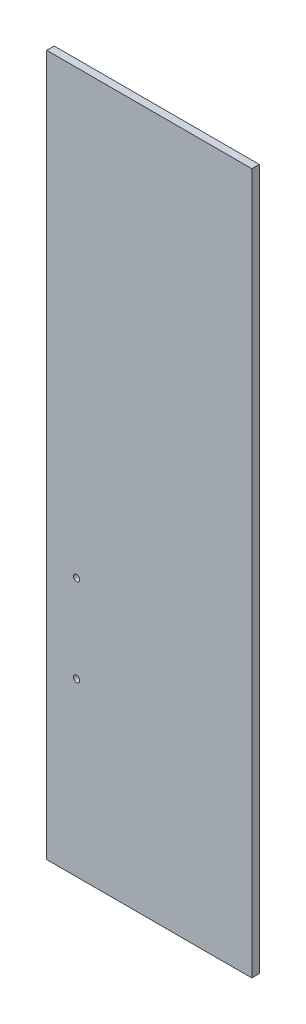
SolidWorks part; units mm, degrees
ref_plane "Plan de face" through (0, 0, 0) normal (0, 0, 1) x (1, 0, 0)
ref_plane "Plan de dessus" through (0, 0, 0) normal (0, 1, 0) x (1, 0, 0)
ref_plane "Plan de droite" through (0, 0, 0) normal (1, 0, 0) x (0, 0, -1)
sketch "Esquisse1" plane through (0, 0, 0) normal (0, 0, 1) x (1, 0, 0)
  line L0 (0, 0) -> (275, 0)
  line L1 (275, 0) -> (275, 940)
  line L3 (275, 940) -> (0, 940)
  line L4 (0, 940) -> (0, 0)
  dimension "D1" = 275
  dimension "D2" = 940
extrude "Extrusion1" add sketch "Esquisse1" along normal blind 10
hole_wizard "Diamètre du perçage M8.5 (8.500000)1" positions "Esquisse3" profile "Esquisse2" hole size "M8.5" standard "ISO"
sketch "Esquisse3" plane through (0, 0, 10) normal (0, 0, 1) x (1, 0, 0)
  line L0 (0, 940) -> (0, 0) construction
  line L1 (0, 0) -> (275, 0) construction
  point P0 (40, 347)
  point P1 (40, 230)
  dimension "D1" = 40
  dimension "D2" = 117
  dimension "D3" = 230
sketch "Esquisse2" plane through (40, 347, 10) normal (1, 0, 0) x (0, -1, 0)
  line L0 (0, 0) -> (0, 10)
  line L1 (0, 10) -> (4.25, 10)
  line L2 (4.25, 10) -> (4.25, 0)
  line L5 (4.25, 0) -> (0, 0)
  line L11 (0, -6.35) -> (0, 107.95) construction
  dimension "Diamètre du perçage jusqu'au prochain" = 8.5
  dimension "Profondeur du perçage jusqu'au prochain" = 10
